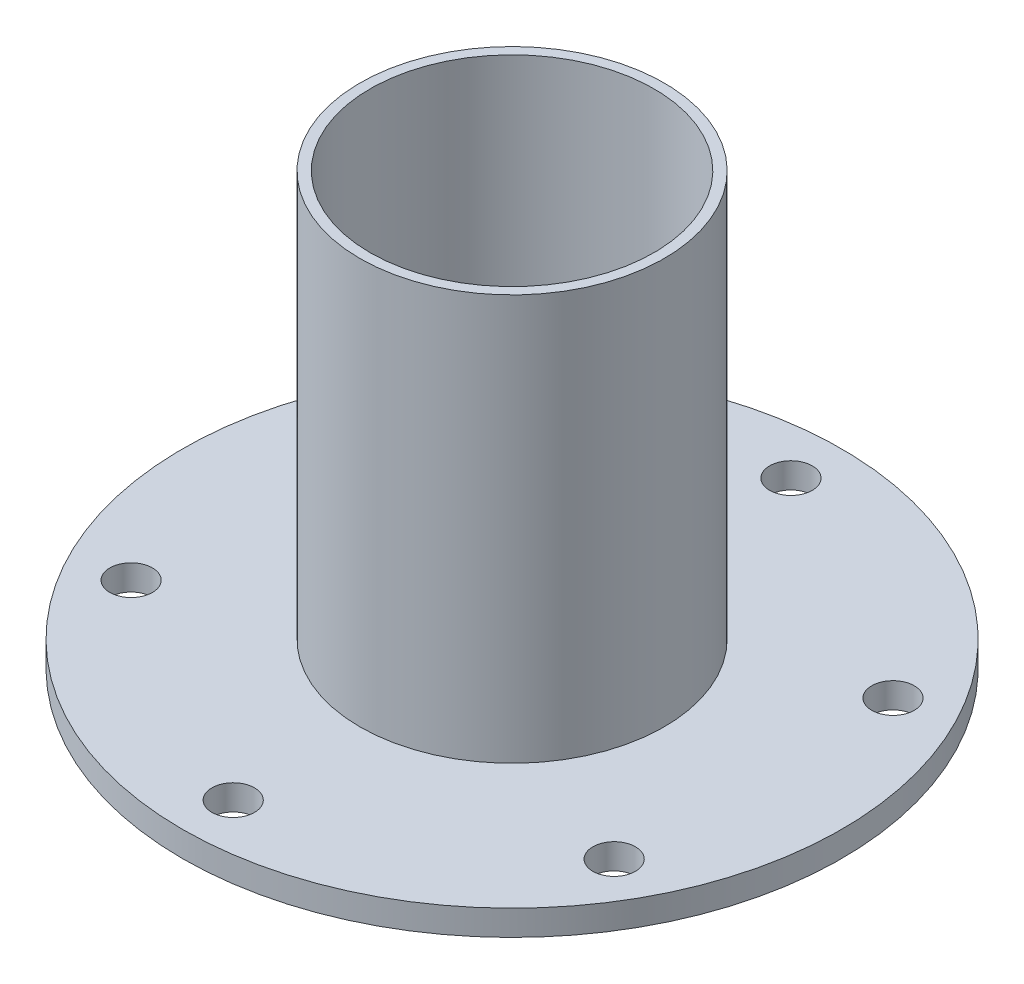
SolidWorks part; units mm, degrees
ref_plane "Front Plane" through (0, 0, 0) normal (0, 0, 1) x (1, 0, 0)
ref_plane "Top Plane" through (0, 0, 0) normal (0, 1, 0) x (1, 0, 0)
ref_plane "Right Plane" through (0, 0, 0) normal (1, 0, 0) x (0, 0, -1)
sketch "Sketch1" plane through (0, 0, 0) normal (0, 1, 0) x (1, 0, 0)
  circle A0 centre (0, 0) radius 41.275
  circle A1 centre (0, 0) radius 34.925 construction
  circle A2 centre (0, 0) radius 28.575 construction
  circle A3 centre (0, 34.925) radius 2.667
  circle A4 centre (30.2459, 17.4625) radius 2.667
  circle A5 centre (30.2459, -17.4625) radius 2.667
  circle A6 centre (0, -34.925) radius 2.667
  circle A7 centre (-30.2459, -17.4625) radius 2.667
  circle A8 centre (-30.2459, 17.4625) radius 2.667
  dimension "D1" = 82.55
  dimension "D2" = 69.85
  dimension "D3" = 6
extrude "Boss-Extrude1" add sketch "Sketch1" along normal blind 3.175
sketch "Sketch2" plane through (0, 3.175, 0) normal (0, 1, 0) x (1, 0, 0)
  circle A0 centre (0, 0) radius 19.05
  circle A1 centre (0, 0) radius 17.78
extrude "Boss-Extrude2" add sketch "Sketch2" along normal blind 50.8
